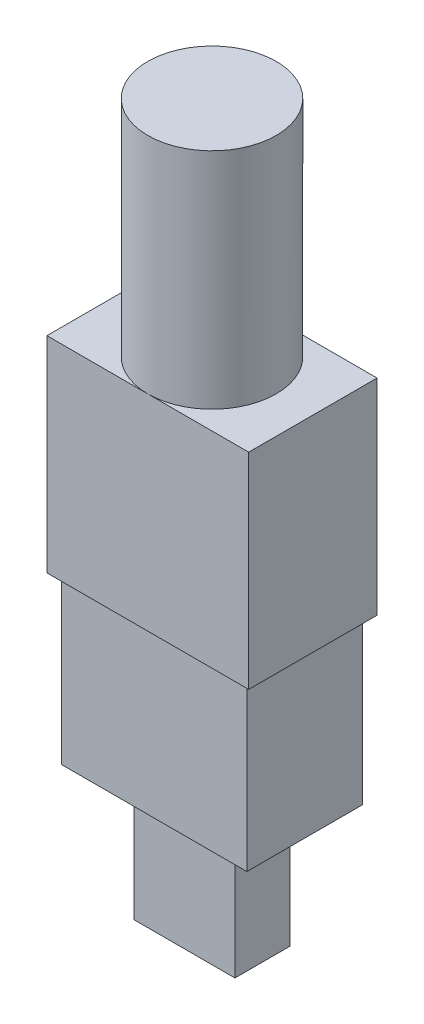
SolidWorks part; units mm, degrees
ref_plane "Front Plane" through (0, 0, 0) normal (0, 0, 1) x (1, 0, 0)
ref_plane "Top Plane" through (0, 0, 0) normal (0, 1, 0) x (1, 0, 0)
ref_plane "Right Plane" through (0, 0, 0) normal (1, 0, 0) x (0, 0, -1)
sketch "Sketch1" plane through (0, 0, 0) normal (0, 1, 0) x (1, 0, 0)
  line L1 (0, 0) -> (5.5, 0)
  line L2 (0, 0) -> (0, 3)
  line L3 (0, 3) -> (5.5, 3)
  line L4 (5.5, 0) -> (5.5, 3)
  dimension "D1" = 3
  dimension "D2" = 5.5
extrude "Boss-Extrude1" add sketch "Sketch1" along normal blind 7
sketch "Sketch2" plane through (0, 7, 0) normal (0, 1, 0) x (1, 0, 0)
  line L0 (0, 1.5) -> (5.5, 1.5) construction
  line L1 (0, 3) -> (0, 0) construction
  line L2 (5.5, 0) -> (5.5, 3) construction
  line L4 (-2.3, 4.65) -> (7.8, 4.65)
  line L5 (-2.3, 4.65) -> (-2.3, -1.65)
  line L6 (-2.3, -1.65) -> (7.8, -1.65)
  line L7 (7.8, 4.65) -> (7.8, -1.65)
  line L8 (-2.3, 4.65) -> (7.8, -1.65) construction
  line L9 (-2.3, -1.65) -> (7.8, 4.65) construction
  point P6 (2.75, 1.5)
  dimension "D1" = 10.1
  dimension "D2" = 6.3
extrude "Boss-Extrude2" add sketch "Sketch2" along normal blind 9
sketch "Sketch3" plane through (0, 16, 0) normal (0, 1, 0) x (1, 0, 0)
  line L0 (-2.3, 1.5) -> (7.8, 1.5) construction
  line L1 (-2.3, 4.65) -> (-2.3, -1.65) construction
  line L2 (7.8, -1.65) -> (7.8, 4.65) construction
  line L4 (-2.75, 5) -> (8.25, 5)
  line L5 (-2.75, 5) -> (-2.75, -2)
  line L6 (-2.75, -2) -> (8.25, -2)
  line L7 (8.25, 5) -> (8.25, -2)
  line L8 (-2.75, 5) -> (8.25, -2) construction
  line L9 (-2.75, -2) -> (8.25, 5) construction
  point P6 (2.75, 1.5)
  dimension "D1" = 7
  dimension "D2" = 11
extrude "Boss-Extrude3" add sketch "Sketch3" along normal blind 11.2
sketch "Sketch4" plane through (0, 27.2, 0) normal (0, 1, 0) x (1, 0, 0)
  line L0 (-2.75, 1.5) -> (8.25, 1.5) construction
  line L1 (-2.75, 5) -> (-2.75, -2) construction
  line L2 (8.25, -2) -> (8.25, 5) construction
  circle A0 centre (2.75, 1.5) radius 3.5
  dimension "D1" = 7
extrude "Boss-Extrude4" add sketch "Sketch4" along normal blind 12.2
